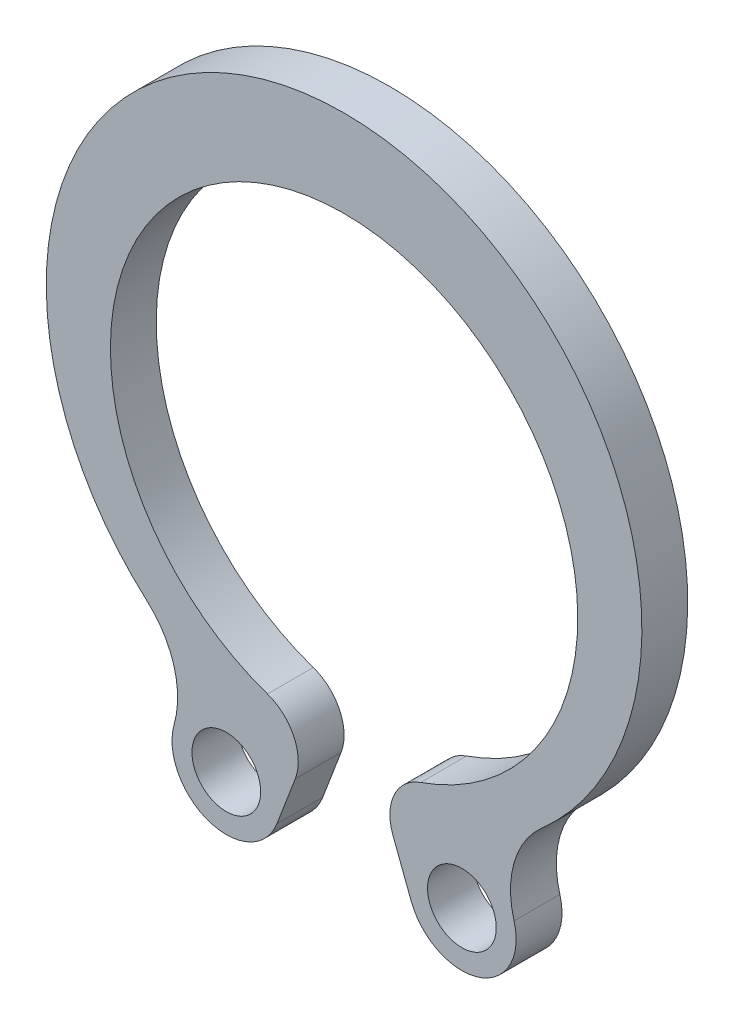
SolidWorks part; units mm, degrees
ref_plane "Спереди" through (0, 0, 0) normal (0, 0, 1) x (1, 0, 0)
ref_plane "Сверху" through (0, 0, 0) normal (0, 1, 0) x (1, 0, 0)
ref_plane "Справа" through (0, 0, 0) normal (1, 0, 0) x (0, 0, -1)
sketch "Clipboard" plane through (0, 0, 0) normal (0, 0, 1) x (1, 0, 0)
  circle A0 centre (0, 0) radius 5.5
  dimension "D1" = 11
sketch "Sketch1" plane through (0, 0, 0) normal (0, 0, 1) x (1, 0, 0)
  line L0 (0, -8.8044) -> (0, 8.5575) construction
  line L1 (0, 0) -> (-2.5709, -6.7418) construction
  line L2 (-2.5709, -6.7418) -> (-3.2717, -6.4746) construction
  line L3 (0, 0) -> (2.5709, -6.7418) construction
  line L4 (1.0656, -6.1191) -> (1.4641, -7.1639)
  line L5 (-1.4641, -7.1639) -> (-1.0656, -6.1191)
  arc A0 (-4.3073, -4.3679) -> (4.3073, -4.3679) centre (0, 0.5) cw
  arc A2 (-3.7098, -6.4159) -> (-1.4641, -7.1639) centre (-2.5709, -6.7418) ccw
  arc A3 (-3.7098, -6.4159) -> (-4.3073, -4.3679) centre (-5.6327, -5.8658) ccw
  arc A4 (-1.6721, -4.8181) -> (-1.0656, -6.1191) centre (-2, -5.7628) cw
  circle A5 centre (-2.5709, -6.7418) radius 0.75
  circle A6 centre (2.5709, -6.7418) radius 0.75
  arc A7 (1.6721, -4.8181) -> (1.0656, -6.1191) centre (2, -5.7628) ccw
  arc A8 (3.7098, -6.4159) -> (4.3073, -4.3679) centre (5.6327, -5.8658) cw
  arc A9 (3.7098, -6.4159) -> (1.4641, -7.1639) centre (2.5709, -6.7418) cw
  arc A11 (1.6721, -4.8181) -> (-1.6721, -4.8181) centre (0, 0) ccw
  dimension "D2" = 10.2
  dimension "D3" = 13
  dimension "D4" = 1.5
  dimension "R1" = 2
  dimension "R2" = 1
  dimension "a" = 3.3
  dimension "L" = 2
  dimension "e" = 0.5
extrude "Body" add sketch "Sketch1" along normal blind 1
